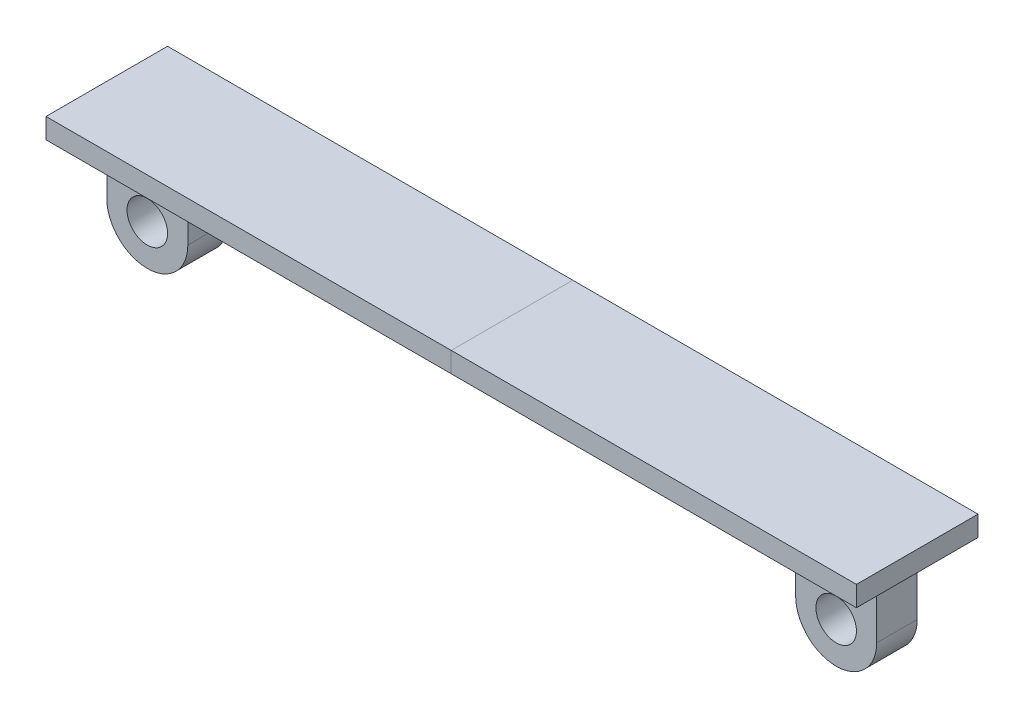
SolidWorks part; units mm, degrees
ref_plane "Front Plane" through (0, 0, 0) normal (0, 0, 1) x (1, 0, 0)
ref_plane "Top Plane" through (0, 0, 0) normal (0, 1, 0) x (1, 0, 0)
ref_plane "Right Plane" through (0, 0, 0) normal (1, 0, 0) x (0, 0, -1)
sketch "Sketch1" plane through (0, 0, 0) normal (0, 1, 0) x (1, 0, 0)
  line L0 (0, 0) -> (0, 95.1694) construction
  line L1 (0, 0) -> (117.2377, 0) construction
  line L3 (-200, 30) -> (200, 30)
  line L4 (-200, 30) -> (-200, -30)
  line L5 (-200, -30) -> (200, -30)
  line L6 (200, 30) -> (200, -30)
  dimension "D1" = 400
  dimension "D2" = 200
  dimension "D3" = 60
  dimension "D4" = 30
extrude "Extrude1" add sketch "Sketch1" against normal blind 10
sketch "Sketch2" plane through (0, -10, 0) normal (0, -1, 0) x (1, 0, 0)
  line L0 (0, 0) -> (-219.0879, 0) construction
  line L1 (-170, 10) -> (-170, -10) construction
  line L2 (-190, -10) -> (-150, -10)
  line L3 (-190, -10) -> (-190, 10)
  line L4 (-190, 10) -> (-150, 10)
  line L5 (-150, -10) -> (-150, 10)
  line L6 (0, 0) -> (0, -104.2356) construction
  dimension "D1" = 40
  dimension "D2" = 20
  dimension "D3" = 20
  dimension "D4" = 10
  dimension "D5" = 340
extrude "Extrude2" add sketch "Sketch2" along normal blind 50
fillet "Fillet1" radius 20 4 edges at (-190, -60, 0) (-170, -60, -10) (-150, -60, 0) (-170, -60, 10)
sketch "Sketch3" plane through (0, 0, -10) normal (0, 0, -1) x (1, 0, 0)
  circle A0 centre (-170, 40) radius 10
  arc A1 (-170, 60) -> (-190, 40) centre (-170, 40) ccw construction
  dimension "D1" = 20
extrude "Cut-Extrude1" cut sketch "Sketch3" against normal through all
fillet "Fillet2" radius 5 2 edges at (-190, -10, 0) (-150, -10, 0)
mirror "Mirror1" about plane through (0, 0, 0) normal (1, 0, 0) of "Fillet2", "Extrude2", "Fillet1", "Cut-Extrude1"
sketch "Sketch4" plane through (0, 0, 0) normal (0, 1, 0) x (-1, 0, 0)
  line L0 (0, -30) -> (0, 30)
  line L1 (-200, -30) -> (200, -30) construction
  line L2 (200, 30) -> (-200, 30) construction
equation "\"D2@Sketch1\" = \"D1@Sketch1\"/2"
equation "\"D4@Sketch1\" = \"D3@Sketch1\"/2"
equation "\"D2@Sketch2\" = \"D1@Sketch2\"/2"
